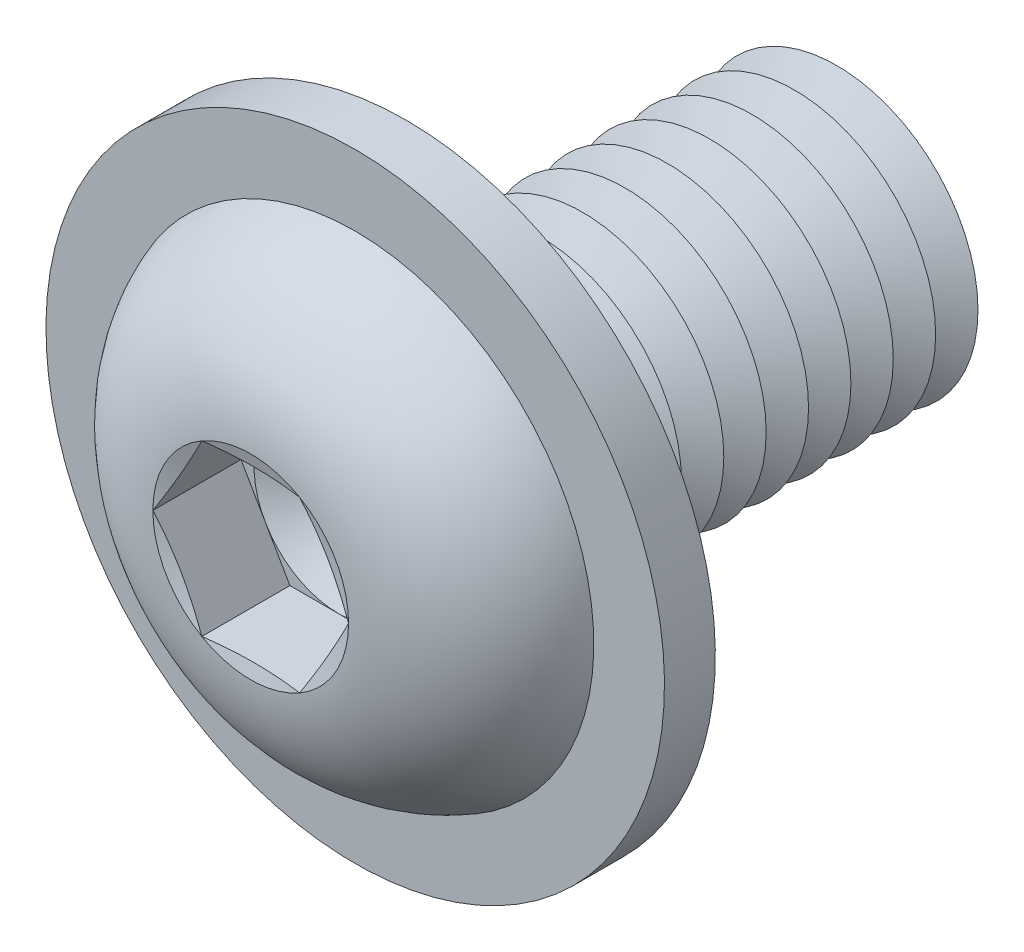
SolidWorks part; units mm, degrees
ref_plane "Front Plane" through (0, 0, 0) normal (0, 0, 1) x (1, 0, 0)
ref_plane "Top Plane" through (0, 0, 0) normal (0, 1, 0) x (1, 0, 0)
ref_plane "Right Plane" through (0, 0, 0) normal (1, 0, 0) x (0, 0, -1)
sketch "Sketch1" plane through (0, 0, 0) normal (1, 0, 0) x (0, 0, -1)
  line L0 (0, 5) -> (0, 8.75)
  line L3 (0, 5) -> (16, 5)
  line L4 (16, 5) -> (16, 0)
  line L5 (16, 0) -> (-5.5, 0) construction
  line L6 (-5.5, 0) -> (16, 0)
  line L7 (-5.5, 3.4641) -> (-5.5, 1.732) construction
  line L8 (-5.5, 1.732) -> (-5.5, 0)
  line L9 (-5.5, 3.4641) -> (-5.0359, 1.732)
  line L10 (-5.0359, 1.732) -> (-5.5, 1.732)
  line L11 (16, 0) -> (22.7481, 0) construction
  line L12 (0, 8.75) -> (-5.5, 8.75) construction
  arc A1 (0, 8.75) -> (-5.5, 3.4641) centre (0, 3.2457) ccw
  point P8 (16, 2.5)
  dimension "D1" = 17.5
  dimension "D2" = 10
  dimension "D3" = 5.5
  dimension "D4" = 6.9282
  dimension "D5" = 16
  dimension "D6" = 15
revolve "Revolve1" add sketch "Sketch1" angle 360 about L5
fillet "Fillet1" radius 0.75 1 edges at (-5, 0, 0)
sketch "Sketch2" plane through (0, 0, 0) normal (1, 0, 0) x (0, 0, -1)
  line L0 (15.25, 5) -> (16.75, 5)
  line L1 (16, 5) -> (0.75, 5) construction
  line L2 (16.75, 5) -> (16, 3.701)
  line L3 (16, -5) -> (16, 5) construction
  line L4 (16, 3.701) -> (15.25, 5)
  dimension "D1" = 1.5
revolve "Cut-Revolve1" cut sketch "Sketch2" angle 360 about axis through (0, 0, -16) along (0, 0, -1)
pattern_linear "LPattern1" count 10 spacing 1.5 along (0, 0, 1) of "Cut-Revolve1"
sketch "Sketch3" plane through (0, 0, 5.5) normal (0, 0, 1) x (1, 0, 0)
  line L7 (1.732, 3) -> (-1.7321, 3)
  line L8 (-1.7321, 3) -> (-3.4641, 0)
  line L9 (-3.4641, 0) -> (-1.732, -3)
  line L10 (-1.732, -3) -> (1.732, -3)
  line L11 (1.732, -3) -> (3.4641, 0)
  line L12 (3.4641, 0) -> (1.732, 3)
  circle A0 centre (0, 0) radius 3 construction
  circle A3 centre (0, 0) radius 3.4641 construction
extrude "Cut-Extrude1" cut sketch "Sketch3" against normal blind 3.12
sketch "Sketch4" plane through (0, 0, 2.38) normal (0, 0, 1) x (1, 0, 0)
  line L1 (1.732, 3) -> (-1.7321, 3) construction
  circle A0 centre (0, 0) radius 3
extrude "Cut-Extrude2" cut sketch "Sketch4" against normal through all draft 60
sketch "Sketch5" plane through (0, 0, 0) normal (0, 0, -1) x (-1, 0, 0)
  circle A0 centre (0, 0) radius 10.95
  circle A1 centre (0, 0) radius 5.75
  circle A2 centre (0, 0) radius 5.75 construction
  dimension "D1" = 21.9
extrude "Boss-Extrude1" add sketch "Sketch5" against normal blind 1.8
